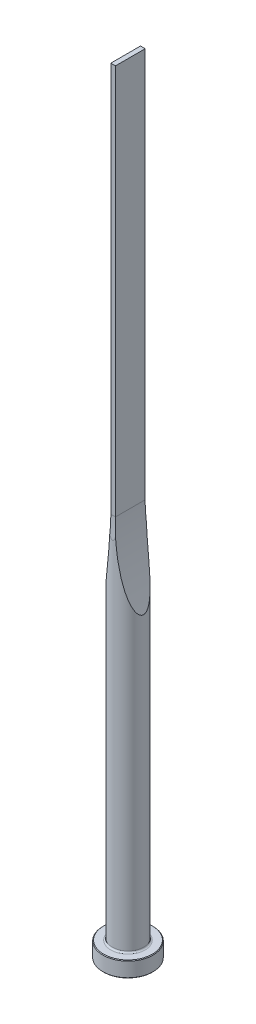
SolidWorks part; units mm, degrees
ref_plane "Front Plane" through (0, 0, 0) normal (0, 0, 1) x (1, 0, 0)
ref_plane "Top Plane" through (0, 0, 0) normal (0, 1, 0) x (1, 0, 0)
ref_plane "Right Plane" through (0, 0, 0) normal (1, 0, 0) x (0, 0, -1)
sketch "Sketch1" plane through (0, 0, 0) normal (0, 0, 1) x (1, 0, 0)
  line L0 (0, 0) -> (7.8, 0)
  line L1 (55, 0) -> (-55, 0) construction
  line L2 (8, 0.2) -> (8, 4.8)
  line L3 (7.8, 5) -> (5.5, 5)
  line L4 (5, 5.5) -> (5, 250)
  line L5 (0, 250) -> (5, 250)
  line L6 (8, 4.8) -> (7.8, 5)
  line L7 (7.8, 0) -> (8, 0.2)
  line L8 (0, 250) -> (0, 0)
  arc A0 (5, 5.5) -> (5.5, 5) centre (5.5, 5.5) ccw
  point P1 (8, 0)
  point P6 (8, 5)
  dimension "D4" = 0.5
  dimension "D1" = 5
  dimension "D2" = 8
  dimension "D3" = 5
  dimension "D5" = 250
revolve "Revolve1" add sketch "Sketch1" angle 360 about L8
sketch "Sketch2" plane through (0, 0, 0) normal (0, 0, 1) x (1, 0, 0)
  line L0 (0.75, 250) -> (0.75, 125)
  line L1 (5, 250) -> (-5, 250) construction
  line L2 (-0.75, 250) -> (-0.75, 125)
  line L3 (5, 250) -> (5, 97.6698)
  line L4 (-5, 250) -> (-5, 97.6698)
  line L5 (0, -55) -> (0, 55) construction
  line L6 (5, 250) -> (0.75, 250)
  line L8 (-0.75, 250) -> (-5, 250)
  arc A0 (0.75, 125) -> (5, 97.6698) centre (90.75, 125) ccw
  arc A1 (-0.75, 125) -> (-5, 97.6698) centre (-90.75, 125) cw
  dimension "D4" = 90
  dimension "D1" = 125
  dimension "D2" = 1.5
  dimension "D3" = 0.75
extrude "Cut-Extrude1" cut sketch "Sketch2" against normal mid plane 10
sketch "Sketch3" plane through (0, 0, 0) normal (1, 0, 0) x (0, 0, -1)
  line L0 (4.75, 250) -> (4.75, 125)
  line L1 (-4.9434, 250) -> (4.9434, 250) construction
  line L2 (-4.75, 250) -> (-4.75, 125)
  line L3 (5, 250) -> (5, 118.2965)
  line L4 (4.75, 250) -> (5, 250)
  line L5 (0, 55) -> (0, -55) construction
  line L6 (-5, 250) -> (-5, 118.2965)
  line L8 (-4.75, 250) -> (-5, 250)
  arc A0 (4.75, 125) -> (5, 118.2965) centre (94.75, 125) ccw
  arc A1 (-4.75, 125) -> (-5, 118.2965) centre (-94.75, 125) cw
  dimension "D2" = 90
  dimension "D1" = 125
  dimension "D3" = 9.5
  dimension "D4" = 4.75
extrude "Cut-Extrude2" cut sketch "Sketch3" against normal mid plane 10
